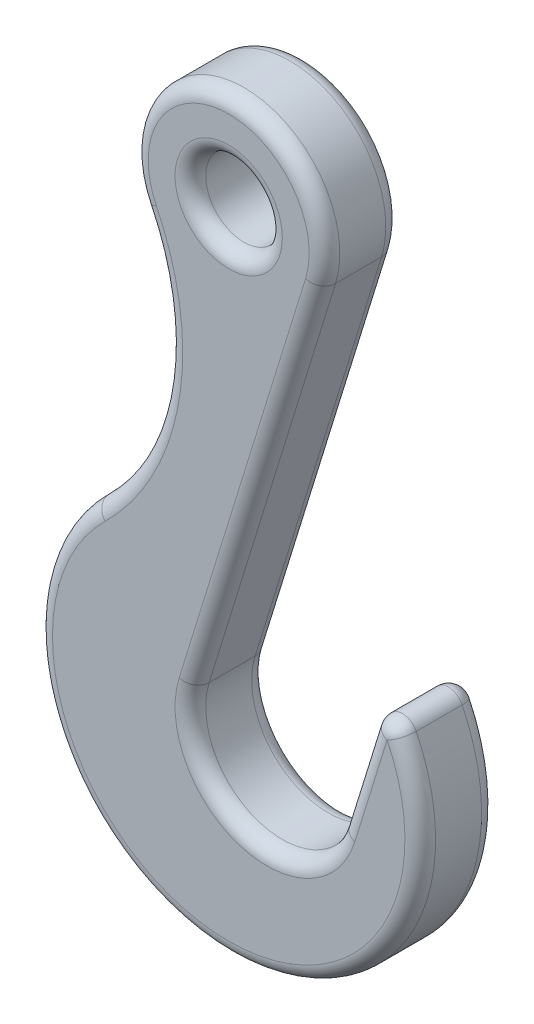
SolidWorks part; units mm, degrees
ref_plane "正面" through (0, 0, 0) normal (0, 0, 1) x (1, 0, 0)
ref_plane "平面" through (0, 0, 0) normal (0, 1, 0) x (1, 0, 0)
ref_plane "右側面" through (0, 0, 0) normal (1, 0, 0) x (0, 0, -1)
sketch "layout1" plane through (0, 0, 0) normal (0, 0, 1) x (1, 0, 0)
  line L0 (5, 0) -> (0, 0) construction
  line L1 (0, 0) -> (0, 60) construction
  circle A0 centre (0, 0) radius 25
  circle A1 centre (5, 0) radius 10
  circle A2 centre (0, 60) radius 12.5
  dimension "D1" = 25
  dimension "D2" = 50
  dimension "D3" = 20
  dimension "D4" = 60
  dimension "D5" = 5
sketch "layout2" plane through (0, 0, 0) normal (0, 0, 1) x (1, 0, 0)
  line L0 (0, 0) -> (0, 60) construction
  circle A0 centre (-39.834, 40.5383) radius 31.834
  circle A1 centre (0, 60) radius 12.5 construction
  circle A2 centre (0, 0) radius 25 construction
  dimension "D1" = 8
sketch "ｽｹｯﾁ3" plane through (0, 0, 0) normal (0, 0, 1) x (1, 0, 0)
  line L0 (11.9422, 56.3077) -> (-4.5538, 2.9539)
  line L1 (14.5538, -2.9539) -> (20.0741, 14.9007)
  circle A1 centre (0, 60) radius 12.5
  arc A2 (11.9422, 56.3077) -> (-11.2312, 54.5128) centre (0, 60) ccw
  circle A3 centre (5, 0) radius 10
  arc A4 (-4.5538, 2.9539) -> (14.5538, -2.9539) centre (5, 0) ccw
  circle A5 centre (0, 0) radius 25
  arc A6 (-17.5221, 17.8319) -> (20.0741, 14.9007) centre (0, 0) ccw
  circle A7 centre (-39.834, 40.5383) radius 31.834
  arc A8 (-17.5221, 17.8319) -> (-11.2312, 54.5128) centre (-39.834, 40.5383) ccw
  dimension "D1" = 0
  dimension "D2" = 0
  dimension "D3" = 0
  dimension "D4" = 0
extrude "ﾎﾞｽ - 押し出し1" add sketch "ｽｹｯﾁ3" along normal blind 10
sketch "ｽｹｯﾁ4" plane through (0, 0, 0) normal (0, 0, 1) x (1, 0, 0)
  circle A0 centre (0, 60) radius 5
  dimension "D1" = 10
extrude "ｶｯﾄ - 押し出し1" cut sketch "ｽｹｯﾁ4" along normal through all
fillet "ﾌｨﾚｯﾄ1" radius 2 1 edges at (20.0741, 14.9007, 5)
fillet "ﾌｨﾚｯﾄ2" radius 2 16 edges at (5, 60, 0) (2.0461, -9.5538, 0) (3.6942, 29.6308, 0) (-0.9653, 72.4627, 0) (-8.4581, 35.1573, 0) (-4.2383, -24.6381, 0) (20.5222, 12.0697, 0) (16.6593, 3.8563, 0) (5, 60, 10) (-8.4581, 35.1573, 10) (-0.9653, 72.4627, 10) (3.6942, 29.6308, 10) (2.0461, -9.5538, 10) (16.6593, 3.8563, 10) (20.5222, 12.0697, 10) (-4.2383, -24.6381, 10)
